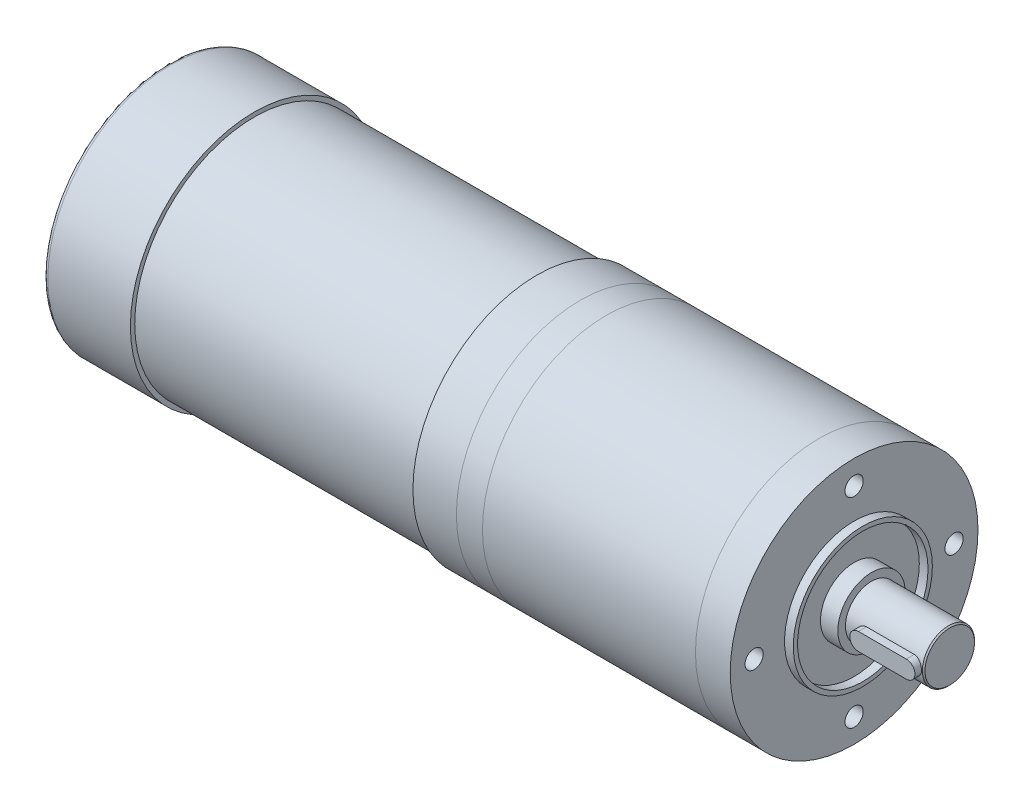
SolidWorks part; units mm, degrees
ref_plane "前视基准面" through (0, 0, 0) normal (0, 0, 1) x (1, 0, 0)
ref_plane "上视基准面" through (0, 0, 0) normal (0, 1, 0) x (1, 0, 0)
ref_plane "右视基准面" through (0, 0, 0) normal (1, 0, 0) x (0, 0, -1)
sketch "草图1" plane through (0, 0, 0) normal (1, 0, 0) x (0, 0, -1)
  circle A0 centre (0, 0) radius 28.5
extrude "凸台-拉伸1" add sketch "草图1" against normal blind 8
sketch "草图2" plane through (-8, 0, 0) normal (-1, 0, 0) x (0, 0, 1)
  circle A0 centre (0, 0) radius 28.5
extrude "凸台-拉伸2" add sketch "草图2" along normal blind 49 separate body
sketch "草图3" plane through (-57, 0, 0) normal (-1, 0, 0) x (0, 0, 1)
  circle A0 centre (0, 0) radius 28.5
extrude "凸台-拉伸3" add sketch "草图3" along normal blind 6 separate body
sketch "草图4" plane through (-63, 0, 0) normal (-1, 0, 0) x (0, 0, 1)
  circle A0 centre (0, 0) radius 28.5
extrude "凸台-拉伸4" add sketch "草图4" along normal blind 10 separate body
sketch "草图5" plane through (-73, 0, 0) normal (-1, 0, 0) x (0, 0, 1)
  circle A0 centre (0, 0) radius 27.5
extrude "凸台-拉伸5" add sketch "草图5" along normal blind 65
sketch "草图6" plane through (-138, 0, 0) normal (-1, 0, 0) x (0, 0, 1)
  circle A0 centre (0, 0) radius 28.5
extrude "凸台-拉伸6" add sketch "草图6" along normal blind 20
fillet "圆角1" radius 1 1 edges at (-158, 0, 28.5)
sketch "草图7" plane through (0, 0, 0) normal (1, 0, 0) x (0, 0, -1)
  circle A0 centre (0, 0) radius 16
  circle A1 centre (0, 0) radius 15
extrude "凸台-拉伸7" add sketch "草图7" along normal blind 2
sketch "草图8" plane through (0, 0, 0) normal (1, 0, 0) x (0, 0, -1)
  circle A0 centre (0, 0) radius 7.75
extrude "凸台-拉伸8" add sketch "草图8" along normal blind 4
sketch "草图9" plane through (4, 0, 0) normal (1, 0, 0) x (0, 0, -1)
  circle A0 centre (0, 0) radius 6
extrude "凸台-拉伸9" add sketch "草图9" along normal blind 18
sketch "草图10" plane through (0, 0, 0) normal (1, 0, 0) x (0, 0, -1)
  point P3 (0, 23)
  point P4 (23, 0)
  point P5 (0, -23)
  point P6 (-23, 0)
hole_wizard "M5 螺纹孔1" positions "3D草图1" profile "草图11" tap size "M5" standard "GB"
sketch3d "3D草图1"
  point P0 (0, 23, 0)
  point P3 (0, 0, -23)
  point P6 (0, -23, 0)
  point P9 (0, 0, 23)
sketch "草图11" plane through (0, 23, 0) normal (0, 1, 0) x (0, 0, -1)
  line L0 (0, 0) -> (0, 15.2618)
  line L1 (0, 15.2618) -> (2.1, 14)
  line L2 (2.1, 14) -> (2.1, 0)
  line L5 (2.1, 0) -> (0, 0)
  line L10 (0, 15.2618) -> (-2.1, 14) construction
  line L11 (0, -6.35) -> (0, 107.95) construction
  dimension "螺纹孔钻头直径" = 4.2
  dimension "螺纹孔钻头深度" = 14
  dimension "导头角度" = 118
ref_plane "基准面1" through (0, 0, 6) normal (0, 0, 1) x (1, 0, 0)
sketch "草图12" plane through (0, 0, 6) normal (0, 0, 1) x (1, 0, 0)
  line L3 (8.5, 2) -> (19.5, 2)
  line L5 (19.5, -2) -> (8.5, -2)
  arc A0 (19.5, -2) -> (19.5, 2) centre (19.5, 0) ccw
  arc A1 (8.5, 2) -> (8.5, -2) centre (8.5, 0) ccw
extrude "切除-拉伸1" cut sketch "草图12" against normal blind 2.5
sketch "草图13" plane through (0, 0, 3.5) normal (0, 0, 1) x (1, 0, 0)
  line L0 (8.5, 2) -> (19.5, 2)
  line L2 (19.5, -2) -> (8.5, -2)
  arc A0 (8.5, 2) -> (8.5, -2) centre (8.5, 0) ccw
  arc A1 (19.5, -2) -> (19.5, 2) centre (19.5, 0) ccw
extrude "凸台-拉伸10" add sketch "草图13" along normal blind 4 separate body
chamfer "倒角1" distance 0.3 angle 45 1 edges at (22, 0, -6)
